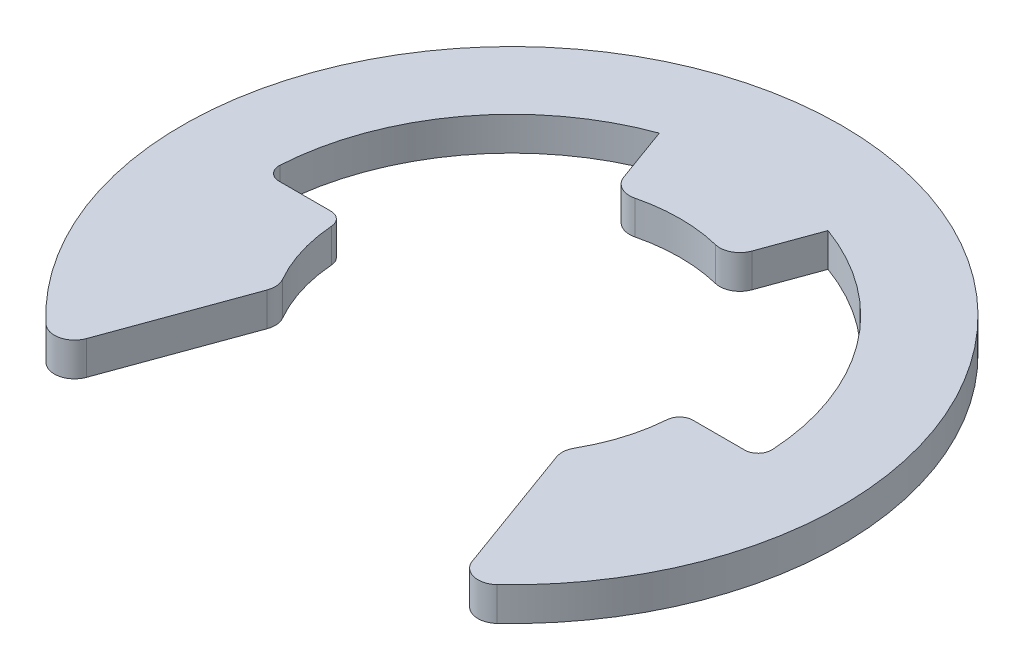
SolidWorks part; units mm, degrees
ref_plane "Front Plane" through (0, 0, 0) normal (0, 0, 1) x (1, 0, 0)
ref_plane "Top Plane" through (0, 0, 0) normal (0, 1, 0) x (1, 0, 0)
ref_plane "Right Plane" through (0, 0, 0) normal (1, 0, 0) x (0, 0, -1)
sketch "Sketch2" plane through (0, 0, 0) normal (0, 1, 0) x (1, 0, 0)
  line L0 (-9.0445, -11.5883) -> (-6.305, -4.0616)
  line L2 (6.305, -4.0616) -> (9.0445, -11.5883)
  line L4 (-7.5, 0) -> (-11, 0)
  line L5 (7.5, 0) -> (11, 0)
  line L6 (-3.7622, 10.3366) -> (-2.5652, 7.0477)
  line L8 (2.5652, 7.0477) -> (3.7622, 10.3366)
  arc A0 (9.0445, -11.5883) -> (-9.0445, -11.5883) centre (0, 0) ccw
  arc A1 (6.305, -4.0616) -> (7.5, 0) centre (0, 0) ccw
  arc A2 (11, 0) -> (3.7622, 10.3366) centre (0, 0) ccw
  arc A3 (-7.5, 0) -> (-6.305, -4.0616) centre (0, 0) ccw
  arc A4 (2.5652, 7.0477) -> (-2.5652, 7.0477) centre (0, 0) ccw
  arc A5 (-3.7622, 10.3366) -> (-11, 0) centre (0, 0) ccw
  point P15 (0, 0)
  point P16 (0, 7.5)
  dimension "D1" = 29.4
  dimension "D2" = 15
  dimension "D3" = 22
  dimension "D4" = 70
  dimension "D5" = 70
  dimension "D6" = 12.61
  dimension "D7" = 40
extrude "Boss-Extrude1" add sketch "Sketch2" along normal mid plane 1.5
fillet "Fillet1" radius 0.9 6 edges at (6.305, 0, 4.0616) (-6.305, 0, 4.0616) (2.5652, 0, -7.0477) (-2.5652, 0, -7.0477) (9.0445, 0, 11.5883) (-9.0445, 0, 11.5883)
fillet "Fillet2" radius 0.6 4 edges at (11, 0, 0) (7.5, 0, 0) (-11, 0, 0) (-7.5, 0, 0)
